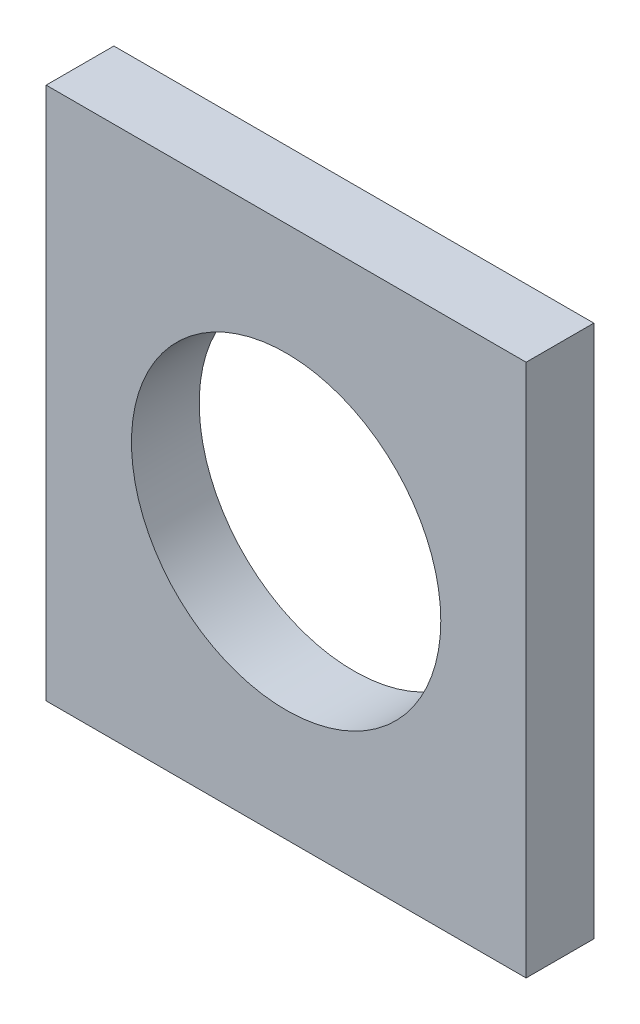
SolidWorks part; units mm, degrees
ref_plane "Front Plane" through (0, 0, 0) normal (0, 0, 1) x (1, 0, 0)
ref_plane "Top Plane" through (0, 0, 0) normal (0, 1, 0) x (1, 0, 0)
ref_plane "Right Plane" through (0, 0, 0) normal (1, 0, 0) x (0, 0, -1)
sketch "Sketch1" plane through (0, 0, 0) normal (0, 0, 1) x (1, 0, 0)
  line L1 (0, 0) -> (45, 0)
  line L2 (0, 0) -> (0, 50)
  line L3 (0, 50) -> (45, 50)
  line L4 (45, 0) -> (45, 50)
  circle A0 centre (22.5, 25) radius 14.5
  dimension "D5" = 29
  dimension "D1" = 50
  dimension "D2" = 45
  dimension "D3" = 22.5
  dimension "D4" = 25
extrude "Boss-Extrude1" add sketch "Sketch1" along normal blind 6.35
